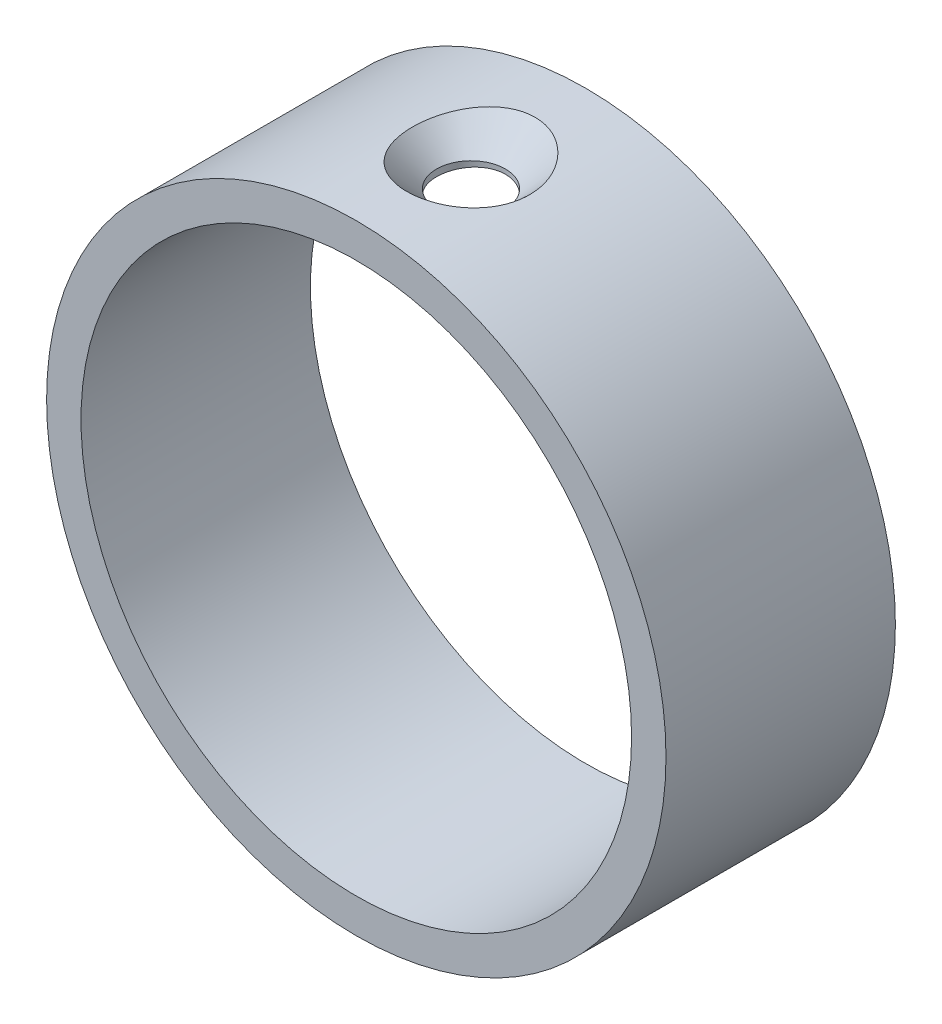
SolidWorks part; units mm, degrees
ref_plane "Front Plane" through (0, 0, 0) normal (0, 0, 1) x (1, 0, 0)
ref_plane "Top Plane" through (0, 0, 0) normal (0, 1, 0) x (1, 0, 0)
ref_plane "Right Plane" through (0, 0, 0) normal (1, 0, 0) x (0, 0, -1)
sketch "Sketch1" plane through (0, 0, 0) normal (0, 0, 1) x (1, 0, 0)
  circle A0 centre (0, 0) radius 13.5
  circle A1 centre (0, 0) radius 12
  dimension "D1" = 27
  dimension "D2" = 24
extrude "Extrude1" add sketch "Sketch1" along normal mid plane 10
sketch "Sketch2" plane through (0, 0, 0) normal (0, 0, 1) x (1, 0, 0)
  line L0 (0, 0) -> (0, 16.7077) construction
  line L1 (0, 0) -> (1.5, 0)
  line L2 (1.5, 0) -> (1.5, 12.2)
  line L3 (1.5, 12.2) -> (6.0077, 16.7077)
  line L4 (6.0077, 16.7077) -> (0, 16.7077)
  line L5 (0, 16.7077) -> (0, 0)
  circle A0 centre (0, 0) radius 12 construction
  point P5 (0, 12)
  dimension "D1" = 45
  dimension "D2" = 0.2
  dimension "D3" = 3
  dimension "D4" = 16.7077
revolve "Cut-Revolve1" cut sketch "Sketch2" angle 360 about L0
